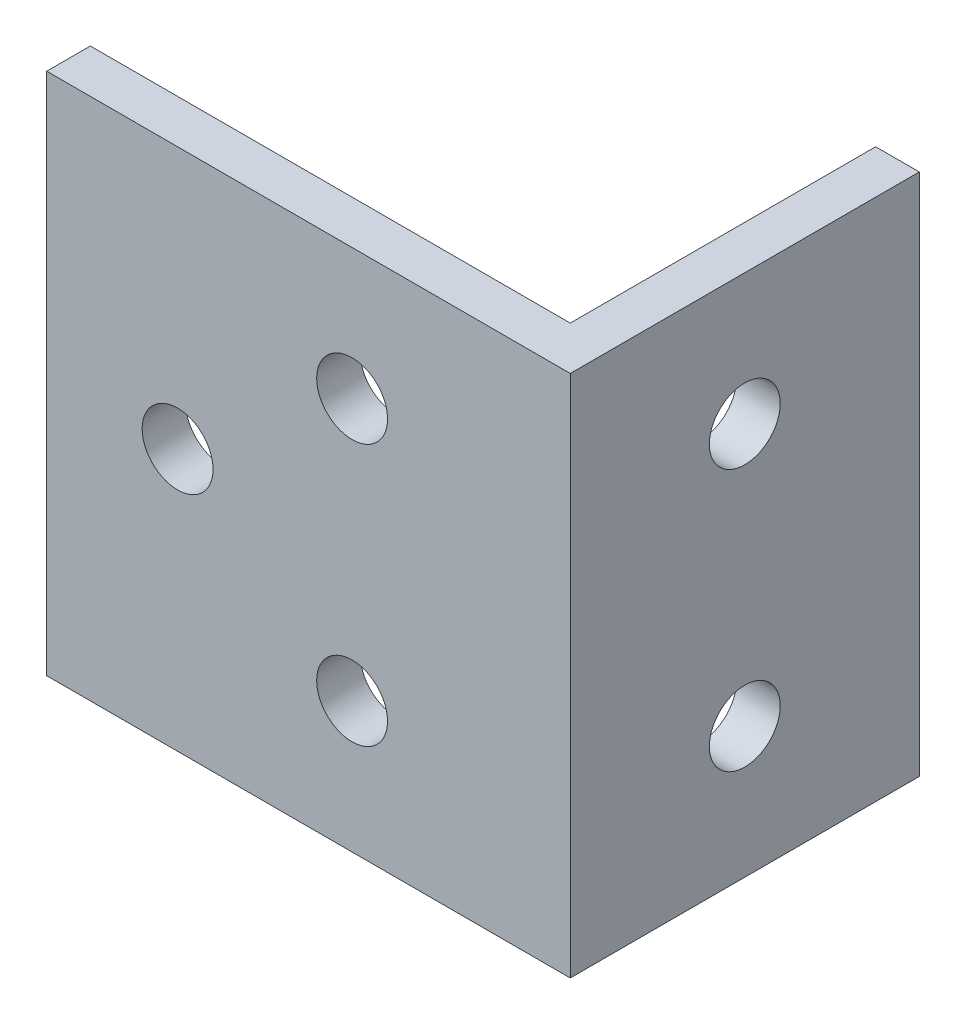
SolidWorks part; units mm, degrees
ref_plane "Front Plane" through (0, 0, 0) normal (0, 0, 1) x (1, 0, 0)
ref_plane "Top Plane" through (0, 0, 0) normal (0, 1, 0) x (1, 0, 0)
ref_plane "Right Plane" through (0, 0, 0) normal (1, 0, 0) x (0, 0, -1)
sketch "Sketch1" plane through (0, 0, 0) normal (0, 0, 1) x (1, 0, 0)
  line L1 (0, 0) -> (-152.4, 0)
  line L2 (0, 0) -> (0, -152.4)
  line L3 (0, -152.4) -> (-152.4, -152.4)
  line L4 (-152.4, 0) -> (-152.4, -152.4)
  dimension "D1" = 152.4
  dimension "D2" = 152.4
extrude "Extrude1" add sketch "Sketch1" along normal blind 12.7
sketch "Sketch2" plane through (0, 0, 0) normal (0, 0, -1) x (-1, 0, 0)
  line L0 (152.4, -152.4) -> (0, -152.4) construction
  line L1 (0, 0) -> (12.7, 0)
  line L2 (0, 0) -> (0, -152.4)
  line L3 (0, -152.4) -> (12.7, -152.4)
  line L4 (12.7, 0) -> (12.7, -152.4)
  dimension "D1" = 12.7
extrude "Extrude2" add sketch "Sketch2" along normal blind 88.9
sketch "Sketch3" plane through (0, 0, 0) normal (0, 0, -1) x (-1, 0, 0)
  line L0 (152.4, 0) -> (152.4, -152.4) construction
  line L1 (152.4, -152.4) -> (12.7, -152.4) construction
  circle A0 centre (63.5, -38.1) radius 10.3188
  dimension "D1" = 20.6375
  dimension "D2" = 88.9
  dimension "D3" = 114.3
extrude "Cut-Extrude1" cut sketch "Sketch3" against normal blind 12.7
sketch "Sketch4" plane through (0, 0, 0) normal (0, 0, -1) x (-1, 0, 0)
  line L0 (12.7, -152.4) -> (12.7, 0) construction
  line L1 (152.4, -152.4) -> (12.7, -152.4) construction
  circle A0 centre (63.5, -114.3) radius 10.3188
  dimension "D1" = 20.6375
  dimension "D2" = 50.8
  dimension "D3" = 38.1
extrude "Cut-Extrude2" cut sketch "Sketch4" against normal blind 12.7
sketch "Sketch5" plane through (0, 0, 0) normal (0, 0, -1) x (-1, 0, 0)
  line L0 (12.7, -152.4) -> (12.7, 0) construction
  line L1 (12.7, 0) -> (152.4, 0) construction
  circle A0 centre (114.3, -76.2) radius 10.3188
  dimension "D1" = 20.6375
  dimension "D2" = 101.6
  dimension "D3" = 76.2
extrude "Cut-Extrude3" cut sketch "Sketch5" against normal blind 12.7
sketch "Sketch6" plane through (0, 0, 0) normal (1, 0, 0) x (0, 0, -1)
  line L0 (-12.7, 0) -> (88.9, 0) construction
  line L1 (88.9, 0) -> (88.9, -152.4) construction
  circle A0 centre (38.1, -38.1) radius 10.3188
  dimension "D1" = 20.6375
  dimension "D2" = 50.8
  dimension "D3" = 38.1
extrude "Cut-Extrude4" cut sketch "Sketch6" against normal blind 12.7
sketch "Sketch7" plane through (0, 0, 0) normal (1, 0, 0) x (0, 0, -1)
  line L0 (-12.7, 0) -> (88.9, 0) construction
  line L1 (88.9, 0) -> (88.9, -152.4) construction
  circle A0 centre (38.1, -114.3) radius 10.3188
  dimension "D1" = 20.6375
  dimension "D2" = 50.8
  dimension "D3" = 114.3
extrude "Cut-Extrude5" cut sketch "Sketch7" against normal blind 12.7
